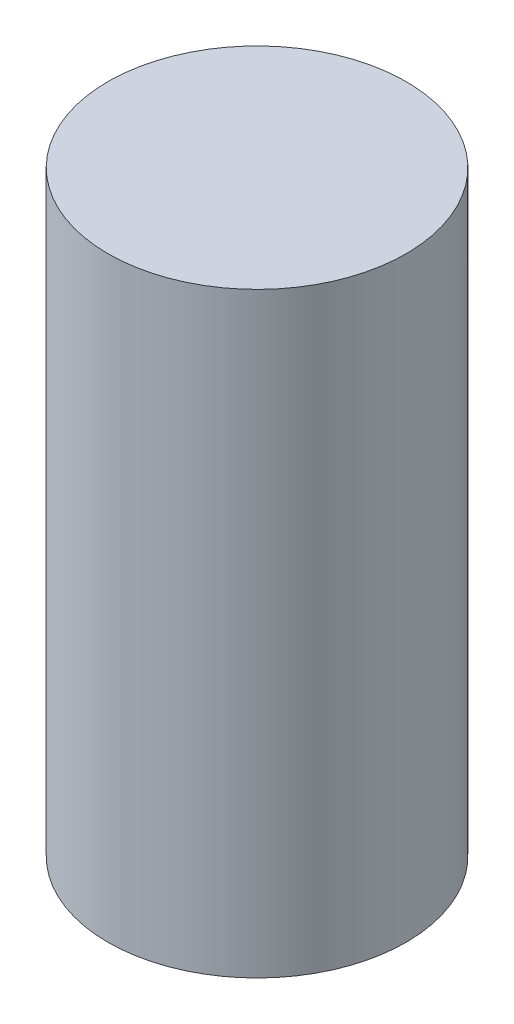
SolidWorks part; units mm, degrees
ref_plane "Front Plane" through (0, 0, 0) normal (0, 0, 1) x (1, 0, 0)
ref_plane "Top Plane" through (0, 0, 0) normal (0, 1, 0) x (1, 0, 0)
ref_plane "Right Plane" through (0, 0, 0) normal (1, 0, 0) x (0, 0, -1)
sketch "Sketch1" plane through (0, 0, 0) normal (0, 1, 0) x (1, 0, 0)
  circle A0 centre (0, 0) radius 6.25
  dimension "D1" = 12.5
extrude "Extrude1" add sketch "Sketch1" along normal blind 25
sketch "Sketch2" plane through (0, 25, 0) normal (0, 1, 0) x (-1, 0, 0)
  point P0 (0, -2.5)
  point P1 (0, 2.5)
  dimension "D1" = 2.5
  dimension "D2" = 5
